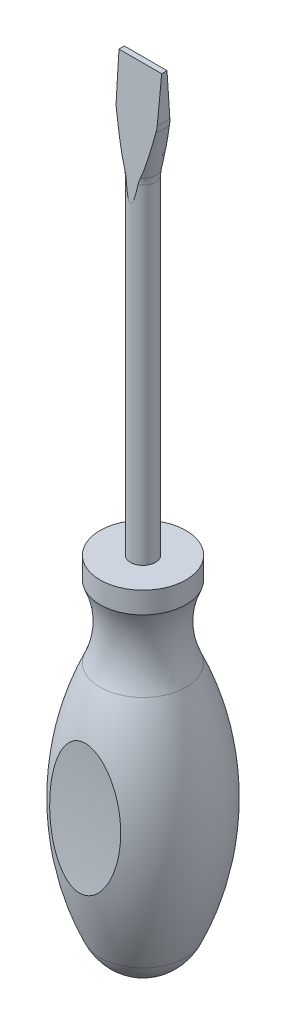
SolidWorks part; units mm, degrees
ref_plane "Front Plane" through (0, 0, 0) normal (0, 0, 1) x (1, 0, 0)
ref_plane "Top Plane" through (0, 0, 0) normal (0, 1, 0) x (1, 0, 0)
ref_plane "Right Plane" through (0, 0, 0) normal (1, 0, 0) x (0, 0, -1)
sketch "BBox" plane through (0, 0, 0) normal (1, 0, 0) x (0, 0, -1)
  line L4 (0, 0) -> (0, 220) construction
  line L5 (0, 100) -> (12, 100) construction
  line L6 (12, 100) -> (12, 0)
  line L7 (12, 0) -> (0, 0)
  line L8 (0, 220) -> (3.5, 220)
  line L9 (3.5, 220) -> (3.5, 100)
  dimension "D1" = 220
  dimension "D2" = 100
  dimension "D3" = 12
  dimension "D4" = 3.5
sketch "Handle" plane through (0, 0, 0) normal (1, 0, 0) x (0, 0, -1)
  line L4 (12, 100) -> (12, 94)
  line L5 (12, 100) -> (12, 0) construction
  line L7 (12, 100) -> (0, 100)
  line L8 (0, 100) -> (0, 0)
  arc A0 (12, 94) -> (12, 74) centre (34.2313, 84) ccw
  arc A1 (12, 74) -> (12, 8.5) centre (-60.8075, 41.25) cw
  arc A2 (12, 8.5) -> (0, 0) centre (-1.2238, 14.4483) cw
  dimension "D1" = 8.5
  dimension "D2" = 14.5
  dimension "D3" = 6
  dimension "D4" = 20
sketch "Grips" plane through (0, 0, 0) normal (1, 0, 0) x (0, 0, -1)
  line L0 (12, 74) -> (32.9937, 74)
  line L1 (32.9937, 74) -> (32.9937, 20)
  line L2 (32.9937, 20) -> (16.1466, 20)
  line L3 (0, 0) -> (0, 99.8972) construction
  line L4 (-32.9937, 20) -> (-16.1466, 20)
  line L5 (-32.9937, 74) -> (-32.9937, 20)
  line L6 (-12, 74) -> (-32.9937, 74)
  arc A0 (12, 74) -> (16.1466, 20) centre (67.4577, 51.0993) ccw
  arc A1 (12, 8.5) -> (12, 74) centre (-60.8075, 41.25) ccw construction
  arc A3 (-12, 74) -> (-16.1466, 20) centre (-67.4577, 51.0993) cw
  dimension "D1" = 60
  dimension "D2" = 20
revolve "Revolve1" add sketch "Handle" angle 360 about L8
sketch "Sketch4" plane through (0, 0, 0) normal (1, 0, 0) x (0, 0, -1)
  line L1 (3.5, 192.1141) -> (3.5, 30)
  line L2 (3.5, 30) -> (0, 30)
  line L3 (0, 0) -> (0, 220) construction
  line L4 (0, 30) -> (0, 220)
  line L5 (3.6557, 193.8721) -> (5.8443, 206.1279)
  line L7 (6, 207.8859) -> (6, 220)
  line L9 (0, 220) -> (6, 220)
  arc A0 (5.8443, 206.1279) -> (6, 207.8859) centre (-4, 207.8859) ccw
  arc A1 (3.6557, 193.8721) -> (3.5, 192.1141) centre (13.5, 192.1141) ccw
  point P12 (6, 207)
  point P16 (3.5, 193)
  dimension "D2" = 6
  dimension "D5" = 10
  dimension "D1" = 30
  dimension "D3" = 13
  dimension "D4" = 14
revolve "Revolve2" add sketch "Sketch4" angle 360 about L4
sketch "Sketch5" plane through (0, 0, 0) normal (0, 0, 1) x (1, 0, 0)
  line L0 (3.5, 80) -> (7.5, 75)
  line L1 (3.5, 30) -> (3.5, 192.1141) construction
  line L2 (7.5, 75) -> (7.5, 65)
  line L3 (7.5, 65) -> (3.5, 60)
  line L4 (3.5, 60) -> (-3.5, 60)
  line L5 (0, 0) -> (0, 220) construction
  line L6 (0, 60) -> (0, 80) construction
  line L7 (-3.5, 80) -> (3.5, 80)
  line L8 (-7.5, 65) -> (-3.5, 60)
  line L9 (-7.5, 75) -> (-7.5, 65)
  line L10 (-3.5, 80) -> (-7.5, 75)
  dimension "D1" = 7.5
  dimension "D2" = 60
  dimension "D3" = 20
  dimension "D4" = 10
extrude "Boss-Extrude2" add sketch "Sketch5" along normal mid plane 3
sketch "Sketch11" plane through (0, 0, 0) normal (1, 0, 0) x (0, 0, -1)
  line L0 (0.75, 220) -> (3.5, 187)
  line L1 (0, 220) -> (3.5, 220) construction
  line L2 (3.5, 220) -> (3.5, 100) construction
  line L3 (0.75, 220) -> (0, 220)
  line L4 (0, 220) -> (0, 230.4461) construction
  line L5 (0.75, 220) -> (10.893, 220)
  line L6 (10.893, 220) -> (10.893, 187)
  line L7 (10.893, 187) -> (3.5, 187)
  line L8 (-0.75, 220) -> (-10.893, 220)
  line L9 (-10.893, 220) -> (-10.893, 187)
  line L10 (-10.893, 187) -> (-3.5, 187)
  line L11 (-0.75, 220) -> (-3.5, 187)
  dimension "D1" = 33
  dimension "D2" = 0.75
extrude "Cut-Extrude4" cut sketch "Sketch11" against normal mid plane 20 contours L7 L6 L5 L0 | L11 L8 L9 L10
sketch "Sketch14" plane through (0, 0, 0) normal (1, 0, 0) x (0, 0, -1)
  line L0 (21.5489, 27) -> (20.6466, 27)
  line L1 (20.6466, 27) -> (20.6466, 62.5)
  line L2 (20.6466, 62.5) -> (16.1466, 62.5)
  line L3 (17.7466, 27) -> (20.6466, 27)
  arc A1 (12, 8.5) -> (12, 74) centre (-60.8075, 41.25) ccw construction
  arc A3 (16.1466, 62.5) -> (17.7466, 27) centre (215.9537, 53.7193) ccw
  dimension "D1" = 4.5
  dimension "D4" = 200
  dimension "D2" = 35.5
  dimension "D3" = 27
  dimension "D5" = 2.9
sketch "Sketch13" plane through (0, 0, 0) normal (1, 0, 0) x (0, 0, -1)
  line L0 (0, 0) -> (0, 102.6432) construction
  line L1 (6.25, 60.8177) -> (12.5, 58.2682)
  line L2 (12.5, 58.2682) -> (12.5, 49.099)
  line L3 (12.5, 49.099) -> (6.25, 46.5495)
  line L4 (-12.5, 39) -> (-7.9779, 39)
  line L5 (12.5, 39) -> (15.0478, 32)
  line L6 (15.0478, 32) -> (9.3864, 26.7329)
  line L7 (0, 63.3672) -> (0, 44) construction
  line L8 (0, 39) -> (0, 18) construction
  line L9 (-15.0478, 32) -> (-9.3864, 26.7329)
  line L10 (-12.5, 39) -> (-15.0478, 32)
  line L11 (-12.5, 49.099) -> (-6.25, 46.5495)
  line L12 (-12.5, 58.2682) -> (-12.5, 49.099)
  line L13 (-6.25, 60.8177) -> (-12.5, 58.2682)
  line L14 (6.25, 58.6577) -> (10.5, 56.924)
  line L15 (10.5, 56.924) -> (10.5, 50.4432)
  line L16 (10.5, 50.4432) -> (6.25, 48.7095)
  line L17 (-10.5, 50.4432) -> (-6.25, 48.7095)
  line L18 (-10.5, 56.924) -> (-10.5, 50.4432)
  line L19 (-6.25, 58.6577) -> (-10.5, 56.924)
  line L20 (11.0996, 37) -> (12.7151, 32.5615)
  line L21 (12.7151, 32.5615) -> (9.103, 29.2009)
  line L22 (-12.7151, 32.5615) -> (-9.103, 29.2009)
  line L23 (-11.0996, 37) -> (-12.7151, 32.5615)
  line L24 (-11.0996, 37) -> (-8.2075, 37)
  line L25 (-6.25, 60.8177) -> (-6.25, 46.5495)
  line L26 (-7.9779, 39) -> (-9.3864, 26.7329)
  line L27 (7.9779, 39) -> (9.3864, 26.7329)
  line L28 (6.25, 60.8177) -> (6.25, 46.5495)
  line L29 (0, 63.3672) -> (-12.5, 58.2682) construction
  line L30 (0, 61.2072) -> (-10.5, 56.924) construction
  line L31 (0, 63.3672) -> (12.5, 58.2682) construction
  line L32 (0, 61.2072) -> (10.5, 56.924) construction
  line L33 (10.5, 50.4432) -> (0, 46.16) construction
  line L34 (12.5, 49.099) -> (0, 44) construction
  line L35 (-10.5, 50.4432) -> (0, 46.16) construction
  line L36 (-12.5, 49.099) -> (0, 44) construction
  line L37 (7.9779, 39) -> (12.5, 39)
  line L38 (-12.5, 39) -> (12.5, 39) construction
  line L39 (8.2075, 37) -> (11.0996, 37)
  line L40 (-11.0996, 37) -> (11.0996, 37) construction
  line L41 (-12.7151, 32.5615) -> (0, 20.7317) construction
  line L42 (-15.0478, 32) -> (0, 18) construction
  line L43 (12.7151, 32.5615) -> (0, 20.7317) construction
  line L44 (15.0478, 32) -> (0, 18) construction
  dimension "D1" = 12.5
  dimension "D2" = 12.5
  dimension "D3" = 18
  dimension "D4" = 44
  dimension "D5" = 19.3672
  dimension "D6" = 110
  dimension "D7" = 7
  dimension "D8" = 14
  dimension "D9" = 13.5
  dimension "D10" = 2
extrude "Cut-Extrude5" cut sketch "Sketch14" against normal through all both and the other way through all contours L1 L2 A3 L3
mirror "Mirror1" about plane through (0, 0, 0) normal (0, 0, 1) of "Cut-Extrude5"
combine bodies "Combine1" operation type add bodies to combine 121 110
